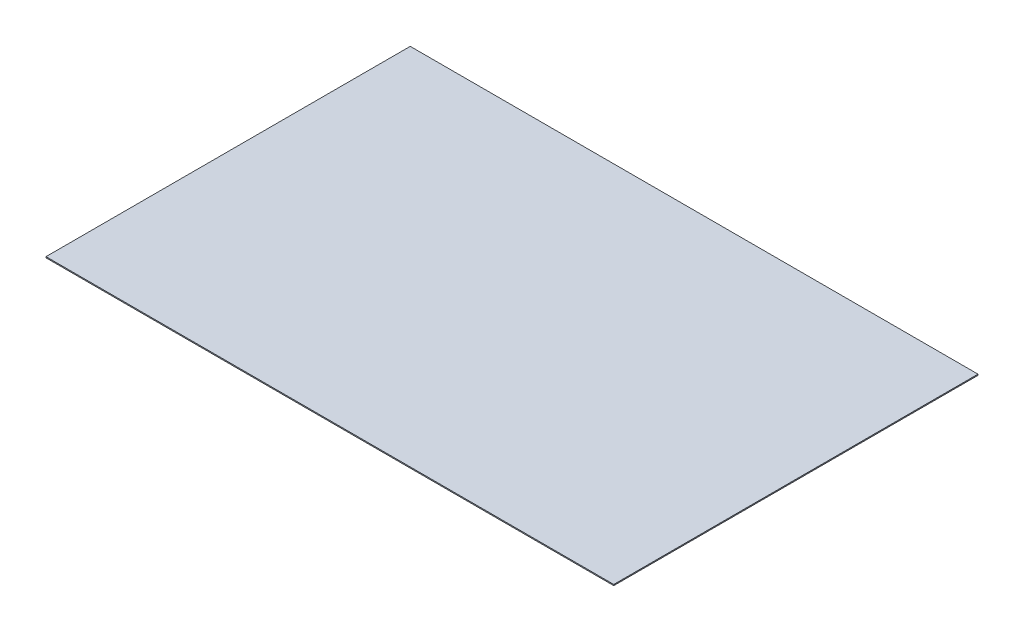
SolidWorks part; units mm, degrees
ref_plane "Front Plane" through (0, 0, 0) normal (0, 0, 1) x (1, 0, 0)
ref_plane "Top Plane" through (0, 0, 0) normal (0, 1, 0) x (1, 0, 0)
ref_plane "Right Plane" through (0, 0, 0) normal (1, 0, 0) x (0, 0, -1)
sketch "Sketch1" plane through (0, 0, 0) normal (0, 1, 0) x (1, 0, 0)
  line L1 (-132.8167, 41.6142) -> (1213.3833, 41.6142)
  line L2 (-132.8167, 41.6142) -> (-132.8167, -821.9858)
  line L3 (-132.8167, -821.9858) -> (1213.3833, -821.9858)
  line L4 (1213.3833, 41.6142) -> (1213.3833, -821.9858)
  dimension "D1" = 1346.2
  dimension "D2" = 863.6
extrude "Boss-Extrude1" add sketch "Sketch1" along normal blind 2.54
